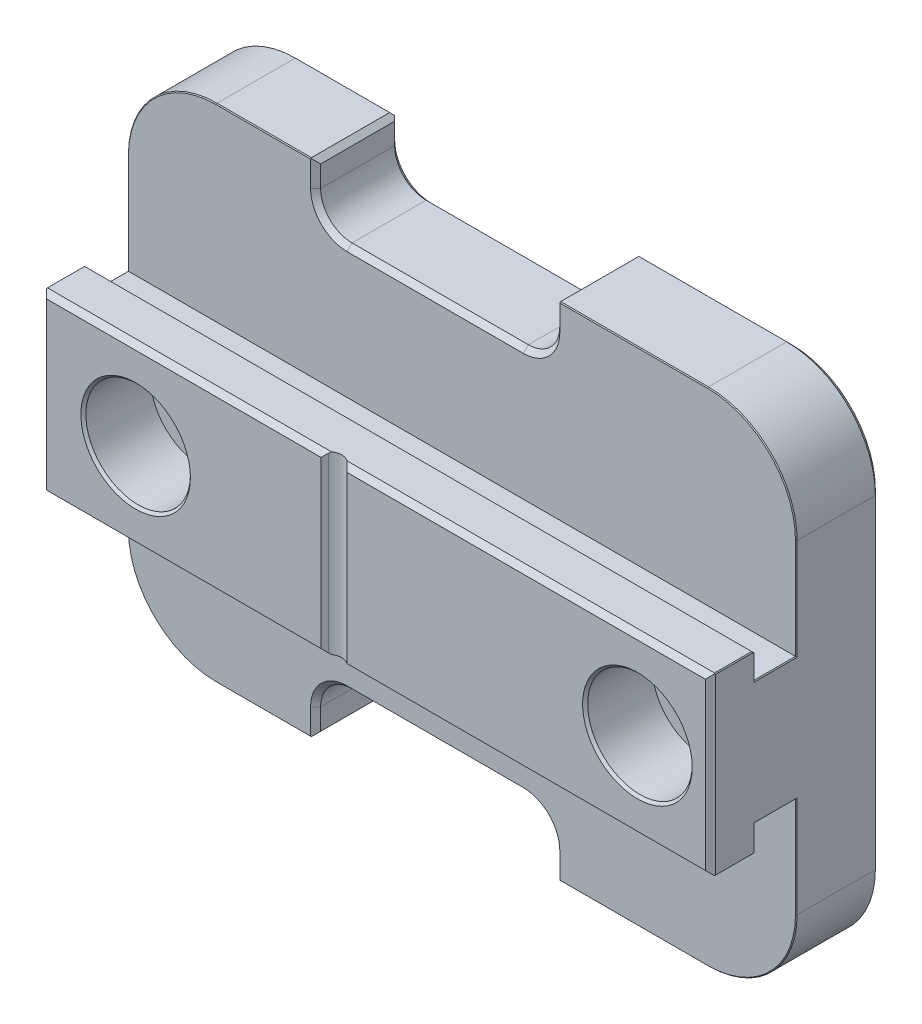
SolidWorks part; units mm, degrees
ref_plane "Front Plane" through (0, 0, 0) normal (0, 0, 1) x (1, 0, 0)
ref_plane "Top Plane" through (0, 0, 0) normal (0, 1, 0) x (1, 0, 0)
ref_plane "Right Plane" through (0, 0, 0) normal (1, 0, 0) x (0, 0, -1)
sketch "Sketch1" plane through (0, 0, 0) normal (1, 0, 0) x (0, 0, -1)
  line L0 (0, 55.8521) -> (0, -55.8521) construction
  line L1 (-12.7635, -38.0746) -> (0, -38.0746)
  line L2 (-25.8191, -13.335) -> (-25.8191, 13.335)
  line L3 (-12.7635, 38.0746) -> (0, 38.0746)
  line L4 (0, -38.0746) -> (0, 38.0746)
  line L5 (-25.4931, 0) -> (10.3829, 0) construction
  line L6 (14.2005, 0) -> (-14.2005, 0) construction
  line L7 (-12.7635, 38.0746) -> (-12.7635, 9.3726)
  line L8 (-12.7635, 9.3726) -> (-19.1643, 9.3726)
  line L9 (-19.1643, 9.3726) -> (-19.1643, 13.335)
  line L10 (-19.1643, 13.335) -> (-25.8191, 13.335)
  line L11 (-19.1643, -9.3726) -> (-19.1643, -13.335)
  line L12 (-19.1643, -13.335) -> (-25.8191, -13.335)
  line L13 (-12.7635, -9.3726) -> (-19.1643, -9.3726)
  line L14 (-12.7635, -38.0746) -> (-12.7635, -9.3726)
  dimension "D1" = 12.7635
  dimension "D2" = 76.1492
  dimension "D3" = 26.67
  dimension "D4" = 6.4008
  dimension "D5" = 18.7452
  dimension "D6" = 13.0556
extrude "Extrude1" add sketch "Sketch1" against normal blind 101.5492
ref_plane "Plane1" through (-50.7746, 0, 0) normal (1, 0, 0) x (0, 0, -1)
sketch "Sketch2" plane through (0, 0, 0) normal (0, 1, 0) x (1, 0, 0)
  line L0 (-11.0744, -33.4035) -> (-11.0744, 19.8166) construction
  line L2 (-11.0744, -25.8191) -> (-11.0744, 2.1758)
  line L3 (-11.0744, 2.1758) -> (-16.4211, 2.1758)
  line L4 (-16.4211, 2.1758) -> (-16.4211, -15.6591)
  line L5 (-16.4211, -15.6591) -> (-19.0119, -15.6591)
  line L6 (-19.0119, -15.6591) -> (-19.0119, -25.8191)
  line L7 (-101.5492, -25.8191) -> (0, -25.8191) construction
  line L8 (-19.0119, -25.8191) -> (-11.0744, -25.8191)
  line L9 (-101.5492, 0) -> (0, 0) construction
  line L11 (-50.7746, -32.1723) -> (-50.7746, 19.8166) construction
  line L12 (0, -14.2005) -> (0, 14.2005) construction
  dimension "D1" = 39.7002
  dimension "D2" = 15.875
  dimension "D3" = 10.6934
  dimension "D4" = 10.16
  dimension "D5" = 2.1758
  dimension "D6" = 50.7746
revolve "Cut-Revolve1" cut sketch "Sketch2" angle 360 about L0
sketch "Sketch3" plane through (0, 0, 0) normal (0, 1, 0) x (1, 0, 0)
  line L0 (-87.2744, -21.5106) -> (-87.2744, 6.8308) construction
  line L2 (-87.2744, -25.8191) -> (-87.2744, 1.0205)
  line L3 (-87.2744, 1.0205) -> (-92.6338, 1.0205)
  line L4 (-92.6338, 1.0205) -> (-92.6338, -15.6591)
  line L5 (-92.6338, -15.6591) -> (-95.2119, -15.6591)
  line L6 (-95.2119, -15.6591) -> (-95.2119, -25.8191)
  line L7 (-101.5492, -25.8191) -> (0, -25.8191) construction
  line L8 (-95.2119, -25.8191) -> (-87.2744, -25.8191)
  line L9 (-55.8521, 0) -> (55.8521, 0) construction
  line L11 (-50.7746, -29.773) -> (-50.7746, 6.8308) construction
  line L12 (0, -14.2005) -> (0, 14.2005) construction
  dimension "D1" = 50.7746
  dimension "D2" = 15.875
  dimension "D3" = 10.7188
  dimension "D4" = 10.16
  dimension "D5" = 1.0205
  dimension "D6" = 36.4998
revolve "Cut-Revolve2" cut sketch "Sketch3" angle 360 about L0
chamfer "Chamfer1" distance 0.381 angle 45 5 edges at (-81.915, 0, 15.6591) (-92.6338, 0, 0) (-16.4211, 0, 0) (-3.1369, 0, 25.8191) (-79.3369, 0, 25.8191)
fillet "Fillet1" radius 13.462 4 edges at (-101.5492, 38.0746, 6.3818) (0, 38.0746, 6.3818) (0, -38.0746, 6.3818) (-101.5492, -38.0746, 6.3818)
sketch "Sketch4" plane through (0, 0, 0) normal (0, 1, 0) x (1, 0, 0)
  line L0 (-57.1246, -28.5966) -> (-57.1246, -13.9074) construction
  line L1 (-55.6878, -25.2747) -> (-51.382, -29.5805)
  line L2 (-51.382, -29.5805) -> (-62.8672, -29.5805)
  line L3 (-62.8672, -29.5805) -> (-58.5614, -25.2747)
  line L5 (-50.7746, -14.2005) -> (-50.7746, 14.2005) construction
  line L7 (-55.6878, -25.2747) -> (-57.1246, -23.8379) construction
  line L8 (-57.1246, -23.8379) -> (-58.5614, -25.2747) construction
  line L9 (-101.5492, -25.8191) -> (0, -25.8191) construction
  arc A0 (-55.6878, -25.2747) -> (-58.5614, -25.2747) centre (-57.1246, -26.7116) ccw
  dimension "D3" = 4.064
  dimension "D4" = 1.9812
  dimension "D1" = 90
  dimension "D2" = 45
  dimension "D5" = 2.8689
  dimension "D6" = 6.35
extrude "Cut-Extrude1" cut sketch "Sketch4" against normal mid plane 57.15
chamfer "Chamfer2" distance 0.762 angle 45 8 edges at (-3.9429, -34.1317, 0) (0, 0, 0) (-3.9429, 34.1317, 0) (-50.7746, 38.0746, 0) (-97.6063, 34.1317, 0) (-101.5492, 0, 0) (-97.6063, -34.1317, 0) (-50.7746, -38.0746, 0)
chamfer "Chamfer3" distance 0.762 angle 45 6 edges at (-27.5717, 13.335, 25.8191) (-80.3275, -13.335, 25.8191) (0, 0, 25.8191) (-101.5492, 0, 25.8191) (-27.5717, -13.335, 25.8191) (-80.3275, 13.335, 25.8191)
chamfer "Chamfer4" distance 0.254 angle 45 2 edges at (-50.7746, 13.335, 19.1643) (-50.7746, -13.335, 19.1643)
chamfer "Chamfer5" distance 0.127 angle 45 14 edges at (-101.5492, 9.3726, 15.9639) (-101.5492, 16.9926, 12.7635) (-97.6063, 34.1317, 12.7635) (-50.7746, 38.0746, 12.7635) (-3.9429, 34.1317, 12.7635) (0, 16.9926, 12.7635) (0, 9.3726, 15.9639) (-101.5492, -9.3726, 15.9639) (0, -9.3726, 15.9639) (0, -16.9926, 12.7635) (-3.9429, -34.1317, 12.7635) (-101.5492, -16.9926, 12.7635) (-97.6063, -34.1317, 12.7635) (-50.7746, -38.0746, 12.7635)
chamfer "Chamfer6" distance 0.127 angle 45 4 edges at (-101.5492, 13.335, 22.2377) (0, 13.335, 22.2377) (0, -13.335, 22.2377) (-101.5492, -13.335, 22.2377)
sketch "Sketch7" plane through (0, 0, 12.7635) normal (0, 0, 1) x (1, 0, 0)
  line L0 (-50.9016, 53.1475) -> (-50.9016, -50.2802) construction
  line L1 (-72.9996, 29.3116) -> (-36.6776, 29.3116)
  line L2 (-72.9996, 29.3116) -> (-72.9996, 43.7886)
  line L3 (-72.9996, 43.7886) -> (-36.6776, 43.7886)
  line L4 (-36.6776, 29.3116) -> (-36.6776, 43.7886)
  line L5 (-0.127, -24.6126) -> (-0.127, -9.3726) construction
  line L6 (-13.462, 37.9476) -> (-88.0872, 37.9476) construction
  dimension "D1" = 36.322
  dimension "D2" = 50.7746
  dimension "D3" = 14.224
  dimension "D4" = 8.636
extrude "Cut-Extrude3" cut sketch "Sketch7" against normal blind 25.4
mirror "Mirror1" about plane through (0, 0, 0) normal (0, 1, 0) of "Cut-Extrude3"
fillet "Fillet3" radius 4.7752 4 edges at (-72.9996, -29.3116, 6.3817) (-36.6776, -29.3116, 6.3817) (-72.9996, 29.3116, 6.3817) (-36.6776, 29.3116, 6.3817)
chamfer "Chamfer8" distance 0.762 angle 45 4 edges at (-36.6776, -38.0746, 6.6993) (-72.9996, -38.0746, 6.6993) (-36.6776, 38.0746, 6.6993) (-72.9996, 38.0746, 6.6993)
chamfer "Chamfer9" distance 0.762 angle 45 10 edges at (-72.9996, 35.6997, 12.7635) (-36.6776, 35.6997, 12.7635) (-71.601, 30.7102, 12.7635) (-38.0762, 30.7102, 12.7635) (-54.8386, 29.3116, 12.7635) (-72.9996, -35.6997, 12.7635) (-36.6776, -35.6997, 12.7635) (-71.601, -30.7102, 12.7635) (-38.0762, -30.7102, 12.7635) (-54.8386, -29.3116, 12.7635)
chamfer "Chamfer10" distance 0.762 angle 45 10 edges at (-36.6776, 35.6997, 0) (-72.9996, 35.6997, 0) (-38.0762, 30.7102, 0) (-71.601, 30.7102, 0) (-54.8386, 29.3116, 0) (-36.6776, -35.6997, 0) (-72.9996, -35.6997, 0) (-38.0762, -30.7102, 0) (-71.601, -30.7102, 0) (-54.8386, -29.3116, 0)
